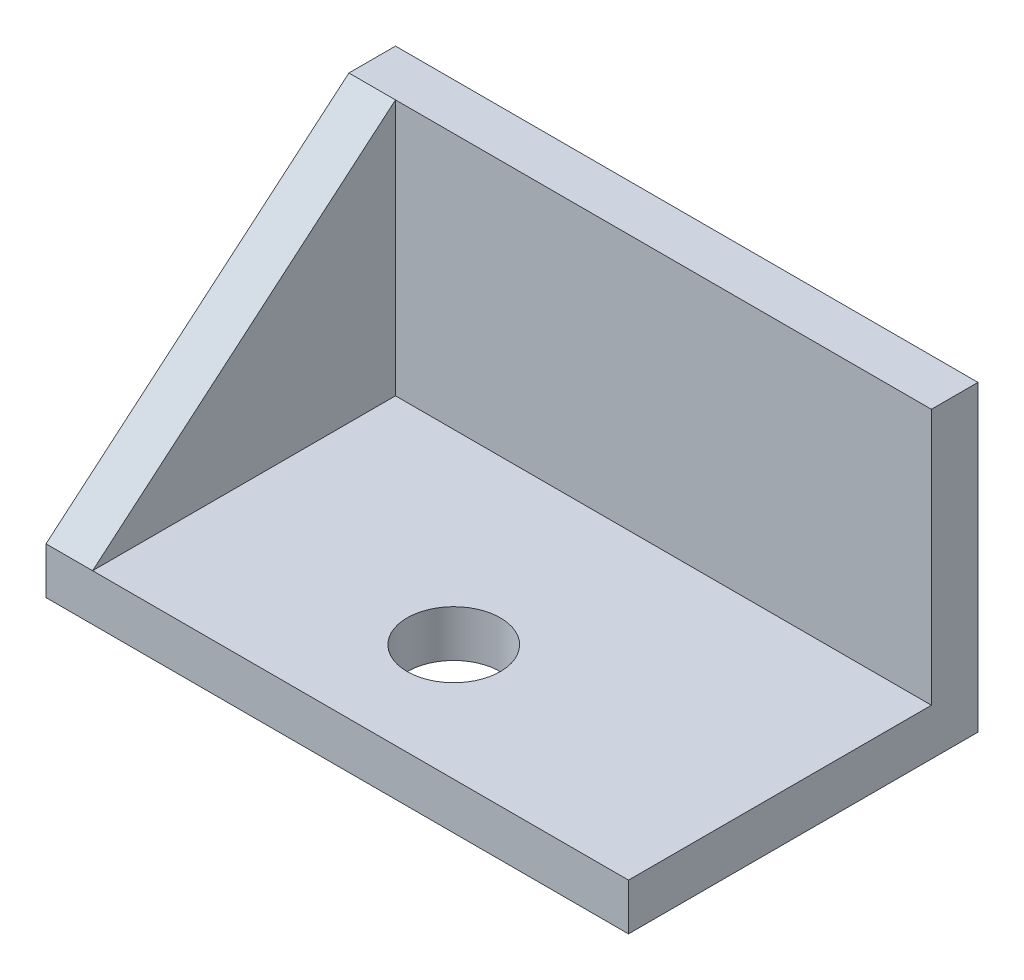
SolidWorks part; units mm, degrees
ref_plane "Front Plane" through (0, 0, 0) normal (0, 0, 1) x (1, 0, 0)
ref_plane "Top Plane" through (0, 0, 0) normal (0, 1, 0) x (1, 0, 0)
ref_plane "Right Plane" through (0, 0, 0) normal (1, 0, 0) x (0, 0, -1)
sketch "Sketch1" plane through (0, 0, 0) normal (0, 0, 1) x (1, 0, 0)
  line L1 (0, 0) -> (125, 0)
  line L2 (0, 0) -> (0, 65)
  line L3 (0, 65) -> (125, 65)
  line L4 (125, 0) -> (125, 65)
  dimension "D1" = 125
  dimension "D2" = 65
extrude "Boss-Extrude1" add sketch "Sketch1" along normal blind 75
sketch "Sketch3" plane through (125, 0, 0) normal (1, 0, 0) x (0, 0, -1)
  line L0 (-75, 10) -> (-10, 65)
  line L1 (-75, 0) -> (-75, 65) construction
  line L2 (-75, 65) -> (0, 65) construction
  line L3 (-10, 65) -> (-75, 65)
  line L4 (-75, 65) -> (-75, 10)
  dimension "D1" = 10
  dimension "D2" = 10
extrude "Cut-Extrude1" cut sketch "Sketch3" against normal through all
sketch "Sketch4" plane through (125, 0, 0) normal (1, 0, 0) x (0, 0, -1)
  line L0 (-10, 65) -> (-10, 10)
  line L1 (-10, 10) -> (-75, 10)
  line L2 (-75, 0) -> (-75, 10) construction
  line L3 (-75, 10) -> (-10, 65)
  dimension "D1" = 10
extrude "Cut-Extrude3" cut sketch "Sketch4" against normal blind 115
sketch "Sketch5" plane through (0, 10, 0) normal (0, 1, 0) x (1, 0, 0)
  line L0 (125, -75) -> (125, -10) construction
  line L1 (10, -75) -> (125, -75) construction
  circle A0 centre (62.5, -50) radius 10
  dimension "D3" = 20
  dimension "D1" = 62.5
  dimension "D2" = 25
extrude "Cut-Extrude4" cut sketch "Sketch5" against normal through all
